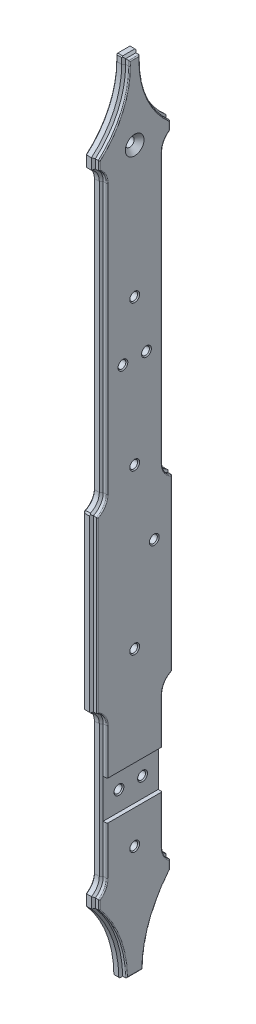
SolidWorks part; units mm, degrees
ref_plane "Спереди" through (0, 0, 0) normal (0, 0, 1) x (1, 0, 0)
ref_plane "Сверху" through (0, 0, 0) normal (0, 1, 0) x (1, 0, 0)
ref_plane "Справа" through (0, 0, 0) normal (1, 0, 0) x (0, 0, -1)
sketch "Эскиз1" plane through (0, 0, 0) normal (1, 0, 0) x (0, 0, -1)
  line L0 (-6, 47) -> (6, 47) construction
  line L1 (0, 0) -> (0, 47) construction
  line L2 (-6, -141.06) -> (6, -141.06) construction
  line L3 (0, -81.06) -> (0, -141.06) construction
  line L4 (0, -225.1986) -> (0, 180.2514) construction
  line L5 (-20, -13.2) -> (-20, -100.9889)
  line L6 (-15, 130.8918) -> (-15, -6.1289)
  line L7 (-20, -13.2) -> (0, -13.2) construction
  line L8 (-19, 137.82) -> (0, 137.82) construction
  line L9 (-19, 143.32) -> (-19, 137.82)
  line L10 (-3.6, 180.2514) -> (3.6, 180.2514)
  line L11 (-3.6, 180.2514) -> (-3.6, 176.7571)
  line L12 (-15, -108.06) -> (-15, -175.26)
  line L13 (-5.08, -225.1986) -> (5.08, -225.1986)
  line L14 (-19, -182.1882) -> (-19, -187.6882)
  line L15 (19, -182.1882) -> (19, -187.6882)
  line L16 (15, -108.06) -> (15, -175.26)
  line L17 (20, -13.2) -> (20, -100.9889)
  line L18 (15, 130.8918) -> (15, -6.1289)
  line L19 (19, 143.32) -> (19, 137.82)
  line L20 (3.6, 180.2514) -> (3.6, 176.7571)
  circle A0 centre (0, 0) radius 2
  circle A1 centre (-6, 47) radius 2
  circle A2 centre (6, 47) radius 2
  circle A3 centre (0, 74) radius 2
  circle A4 centre (0, 140.92) radius 2.25
  circle A5 centre (0, -81.06) radius 2
  circle A6 centre (10, -37.9) radius 2
  circle A7 centre (-6, -141.06) radius 2
  circle A8 centre (6, -141.06) radius 2
  circle A9 centre (0, -168.06) radius 2
  arc A10 (-20, -13.2) -> (-15, -6.1289) centre (-22.5, -6.1289) ccw
  arc A11 (-15, 130.8918) -> (-19, 137.82) centre (-23, 130.8918) ccw
  arc A12 (-19, 143.32) -> (-3.6, 176.7571) centre (-47.6, 176.7571) ccw
  arc A13 (-15, -108.06) -> (-20, -100.9889) centre (-22.5, -108.06) ccw
  arc A14 (-19, -182.1882) -> (-15, -175.26) centre (-23, -175.26) ccw
  arc A15 (-5.08, -225.1986) -> (-19, -187.6882) centre (-62.58, -225.1986) ccw
  arc A16 (5.08, -225.1986) -> (19, -187.6882) centre (62.58, -225.1986) cw
  arc A17 (19, -182.1882) -> (15, -175.26) centre (23, -175.26) cw
  arc A18 (15, -108.06) -> (20, -100.9889) centre (22.5, -108.06) cw
  arc A19 (20, -13.2) -> (15, -6.1289) centre (22.5, -6.1289) cw
  arc A20 (15, 130.8918) -> (19, 137.82) centre (23, 130.8918) cw
  arc A21 (19, 143.32) -> (3.6, 176.7571) centre (47.6, 176.7571) cw
  dimension "D1" = 4
  dimension "D5" = 4.5
  dimension "D16" = 15
  dimension "D19" = 16
  dimension "D22" = 88
  dimension "D26" = 115
  dimension "D2" = 47
  dimension "D3" = 12
  dimension "D4" = 27
  dimension "D6" = 140.92
  dimension "D7" = 81.06
  dimension "D8" = 43.16
  dimension "D9" = 10
  dimension "D10" = 12
  dimension "D11" = 60
  dimension "D12" = 27
  dimension "D13" = 40
  dimension "D14" = 30
  dimension "D15" = 13.2
  dimension "D17" = 3.1
  dimension "D18" = 38
  dimension "D20" = 5.5
  dimension "D21" = 7.2
  dimension "D23" = 27
  dimension "D24" = 7.2
  dimension "D25" = 10.16
  dimension "D27" = 405.45
extrude "Бобышка-Вытянуть1" add sketch "Эскиз1" along normal blind 6
sketch "Эскиз2" plane through (6, 0, 0) normal (1, 0, 0) x (0, 0, -1)
  line L0 (-6, -141.06) -> (6, -141.06) construction
  line L1 (-15, -108.06) -> (-15, -175.26) construction
  line L2 (15, -131.17) -> (-15, -131.17)
  line L3 (15, -131.17) -> (15, -150.95)
  line L4 (15, -150.95) -> (-15, -150.95)
  line L5 (-15, -131.17) -> (-15, -150.95)
  line L6 (15, -131.17) -> (-15, -150.95) construction
  line L7 (15, -150.95) -> (-15, -131.17) construction
  point P4 (0, -141.06)
  dimension "D1" = 19.78
extrude "Вырез-Вытянуть1" cut sketch "Эскиз2" against normal blind 2
chamfer "Фаска1" distance 2.5 angle 45 1 edges at (6, 140.92, -2.25)
sketch "Эскиз3" plane through (6, 0, 0) normal (1, 0, 0) x (0, 0, -1)
  line L0 (-14, -108.06) -> (-14, -175.26)
  line L1 (-18, -182.7433) -> (-18, -187.3189)
  line L2 (-4.0885, -224.1986) -> (4.0885, -224.1986)
  line L3 (18, -187.3189) -> (18, -182.7433)
  line L4 (14, -175.26) -> (14, -108.06)
  line L5 (19, -100.314) -> (19, -13.8749)
  line L6 (15, -150.95) -> (-15, -150.95)
  line L7 (-15, -150.95) -> (-15, -175.26)
  line L8 (-19, -182.1882) -> (-19, -187.6882)
  line L9 (-5.08, -225.1986) -> (5.08, -225.1986)
  line L10 (19, -187.6882) -> (19, -182.1882)
  line L11 (15, -175.26) -> (15, -150.95)
  line L12 (-15, -131.17) -> (15, -131.17)
  line L13 (15, -131.17) -> (15, -108.06)
  line L14 (20, -100.9889) -> (20, -13.2)
  line L15 (15, -6.1289) -> (15, 130.8918)
  line L16 (19, 137.82) -> (19, 143.32)
  line L17 (3.6, 176.7571) -> (3.6, 180.2514)
  line L18 (3.6, 180.2514) -> (-3.6, 180.2514)
  line L19 (-3.6, 180.2514) -> (-3.6, 176.7571)
  line L20 (-19, 143.32) -> (-19, 137.82)
  line L21 (-15, 130.8918) -> (-15, -6.1289)
  line L22 (-20, -13.2) -> (-20, -100.9889)
  line L23 (-15, -108.06) -> (-15, -131.17)
  line L24 (14, -6.1289) -> (14, 130.8918)
  line L25 (15, -175.26) -> (15, -108.06)
  line L26 (20, -100.9889) -> (20, -13.2)
  line L27 (15, -6.1289) -> (15, 130.8918)
  line L28 (19, 137.82) -> (19, 143.32)
  line L29 (3.6, 176.7571) -> (3.6, 180.2514)
  line L30 (3.6, 180.2514) -> (-3.6, 180.2514)
  line L31 (-3.6, 180.2514) -> (-3.6, 176.7571)
  line L32 (-19, 143.32) -> (-19, 137.82)
  line L33 (-15, 130.8918) -> (-15, -6.1289)
  line L34 (-20, -13.2) -> (-20, -100.9889)
  line L35 (-15, -108.06) -> (-15, -175.26)
  line L36 (18, 138.3751) -> (18, 142.8626)
  line L37 (2.6, 176.7571) -> (2.6, 179.2514)
  line L38 (-19, -182.1882) -> (-19, -187.6882)
  line L39 (-5.08, -225.1986) -> (5.08, -225.1986)
  line L40 (19, -187.6882) -> (19, -182.1882)
  line L41 (2.6, 179.2514) -> (-2.6, 179.2514)
  line L42 (-2.6, 179.2514) -> (-2.6, 176.7571)
  line L43 (-18, 142.8626) -> (-18, 138.3751)
  line L44 (-14, 130.8918) -> (-14, -6.1289)
  line L45 (-19, -13.8749) -> (-19, -100.314)
  arc A0 (-18, -182.7433) -> (-14, -175.26) centre (-23, -175.26) ccw
  arc A1 (-4.0885, -224.1986) -> (-18, -187.3189) centre (-62.58, -225.1986) ccw
  arc A2 (18, -187.3189) -> (4.0885, -224.1986) centre (62.58, -225.1986) ccw
  arc A3 (14, -175.26) -> (18, -182.7433) centre (23, -175.26) ccw
  arc A4 (-19, -182.1882) -> (-15, -175.26) centre (-23, -175.26) ccw
  arc A5 (-5.08, -225.1986) -> (-19, -187.6882) centre (-62.58, -225.1986) ccw
  arc A6 (19, -187.6882) -> (5.08, -225.1986) centre (62.58, -225.1986) ccw
  arc A7 (15, -175.26) -> (19, -182.1882) centre (23, -175.26) ccw
  arc A8 (20, -100.9889) -> (15, -108.06) centre (22.5, -108.06) ccw
  arc A9 (15, -6.1289) -> (20, -13.2) centre (22.5, -6.1289) ccw
  arc A10 (19, 137.82) -> (15, 130.8918) centre (23, 130.8918) ccw
  arc A11 (3.6, 176.7571) -> (19, 143.32) centre (47.6, 176.7571) ccw
  arc A12 (-19, 143.32) -> (-3.6, 176.7571) centre (-47.6, 176.7571) ccw
  arc A13 (-15, 130.8918) -> (-19, 137.82) centre (-23, 130.8918) ccw
  arc A14 (-20, -13.2) -> (-15, -6.1289) centre (-22.5, -6.1289) ccw
  arc A15 (-15, -108.06) -> (-20, -100.9889) centre (-22.5, -108.06) ccw
  arc A16 (20, -100.9889) -> (15, -108.06) centre (22.5, -108.06) ccw
  arc A17 (15, -6.1289) -> (20, -13.2) centre (22.5, -6.1289) ccw
  arc A18 (19, 137.82) -> (15, 130.8918) centre (23, 130.8918) ccw
  arc A19 (3.6, 176.7571) -> (19, 143.32) centre (47.6, 176.7571) ccw
  arc A20 (-19, 143.32) -> (-3.6, 176.7571) centre (-47.6, 176.7571) ccw
  arc A21 (-15, 130.8918) -> (-19, 137.82) centre (-23, 130.8918) ccw
  arc A22 (-20, -13.2) -> (-15, -6.1289) centre (-22.5, -6.1289) ccw
  arc A23 (-15, -108.06) -> (-20, -100.9889) centre (-22.5, -108.06) ccw
  arc A24 (-19, -182.1882) -> (-15, -175.26) centre (-23, -175.26) ccw
  arc A25 (-5.08, -225.1986) -> (-19, -187.6882) centre (-62.58, -225.1986) ccw
  arc A26 (19, -187.6882) -> (5.08, -225.1986) centre (62.58, -225.1986) ccw
  arc A27 (15, -175.26) -> (19, -182.1882) centre (23, -175.26) ccw
  arc A28 (19, -100.314) -> (14, -108.06) centre (22.5, -108.06) ccw
  arc A29 (14, -6.1289) -> (19, -13.8749) centre (22.5, -6.1289) ccw
  arc A30 (18, 138.3751) -> (14, 130.8918) centre (23, 130.8918) ccw
  arc A31 (2.6, 176.7571) -> (18, 142.8626) centre (47.6, 176.7571) ccw
  arc A32 (-18, 142.8626) -> (-2.6, 176.7571) centre (-47.6, 176.7571) ccw
  arc A33 (-14, 130.8918) -> (-18, 138.3751) centre (-23, 130.8918) ccw
  arc A34 (-19, -13.8749) -> (-14, -6.1289) centre (-22.5, -6.1289) ccw
  arc A35 (-14, -108.06) -> (-19, -100.314) centre (-22.5, -108.06) ccw
  dimension "D1" = 0
  dimension "D2" = 0
  dimension "D3" = 1
extrude "Вырез-Вытянуть2" cut sketch "Эскиз3" against normal blind 2
chamfer "Фаска2" distance 1 angle 45 26 edges at (4, 180.2514, 0) (4, 178.5042, -3.6) (4, 158.3506, -7.635) (4, 140.57, -19) (4, 178.5042, 3.6) (4, 158.3506, 7.635) (4, 140.57, 19) (4, 134.8918, -16.0718) (4, 62.3814, -15) (4, -10.4591, -16.3763) (4, -57.0945, -20) (4, -103.7299, -16.3763) (4, -141.66, -15) (4, -179.26, -16.0718) (4, -184.9382, -19) (4, -205.1937, -8.6722) (4, -225.1986, 0) (4, -205.1937, 8.6722) (4, -184.9382, 19) (4, -179.26, 16.0718) (4, -141.66, 15) (4, 134.8918, 16.0718) (4, 62.3814, 15) (4, -103.7299, 16.3763) (4, -57.0945, 20) (4, -10.4591, 16.3763)
fillet "Скругление1" radius 0.5 28 edges at (6, 135.1344, -15.0627) (6, 62.3814, -14) (6, -103.4502, -15.3586) (6, -163.105, -14) (6, -179.5026, 15.0627) (6, -119.615, 14) (6, -10.7387, 15.3586) (6, 62.3814, 14) (6, 178.0042, -2.6) (6, 178.0042, 2.6) (6, 140.6188, -18) (6, -10.7387, -15.3586) (6, -57.0945, -19) (6, -119.615, -14) (6, -179.5026, -15.0627) (6, -185.0311, -18) (6, -204.5518, -7.8446) (6, -224.1986, 0) (6, -204.5518, 7.8446) (6, -185.0311, 18) (6, -163.105, 14) (6, -103.4502, 15.3586) (6, -57.0945, 19) (6, 135.1344, 15.0627) (6, 140.6188, 18) (6, 158.1426, -6.6305) (6, 158.1426, 6.6305) (6, 179.2514, 0)
chamfer "Фаска3" distance 0.5 angle 45 53 edges at (0, 74, -2) (6, 74, -2) (0, 47, -8) (6, 47, -8) (0, 47, 4) (6, 47, 4) (0, 0, -2) (6, 0, -2) (0, -37.9, -12) (6, -37.9, -12) (0, -81.06, -2) (6, -81.06, -2) (0, -141.06, -8) (4, -141.06, -4) (0, -141.06, 4) (4, -141.06, 8) (0, -168.06, -2) (6, -168.06, -2) (0, -184.9382, 19) (0, -205.1937, 8.6722) (0, -225.1986, 0) (0, -205.1937, -8.6722) (0, -184.9382, -19) (0, -179.26, -16.0718) (0, -141.66, -15) (0, -103.7299, -16.3763) (0, -57.0945, -20) (0, -179.26, 16.0718) (0, -141.66, 15) (0, -103.7299, 16.3763) (0, -57.0945, 20) (0, 180.2514, 0) (0, -10.4591, -16.3763) (0, 62.3814, -15) (0, 178.5042, -3.6) (0, 134.8918, -16.0718) (0, 140.57, -19) (0, 158.3506, -7.635) (0, -10.4591, 16.3763) (0, 62.3814, 15) (0, 178.5042, 3.6) (0, 134.8918, 16.0718) (0, 158.3506, 7.635) (0, 140.57, 19) (0, 140.92, -2.25) (1.5, -100.9889, 20) (1.5, -100.9889, -20) (1.5, -13.2, -20) (1.5, -13.2, 20) (1.5, -225.1986, -5.08) (1.5, -225.1986, 5.08) (1.5, 180.2514, -3.6) (1.5, 180.2514, 3.6)
